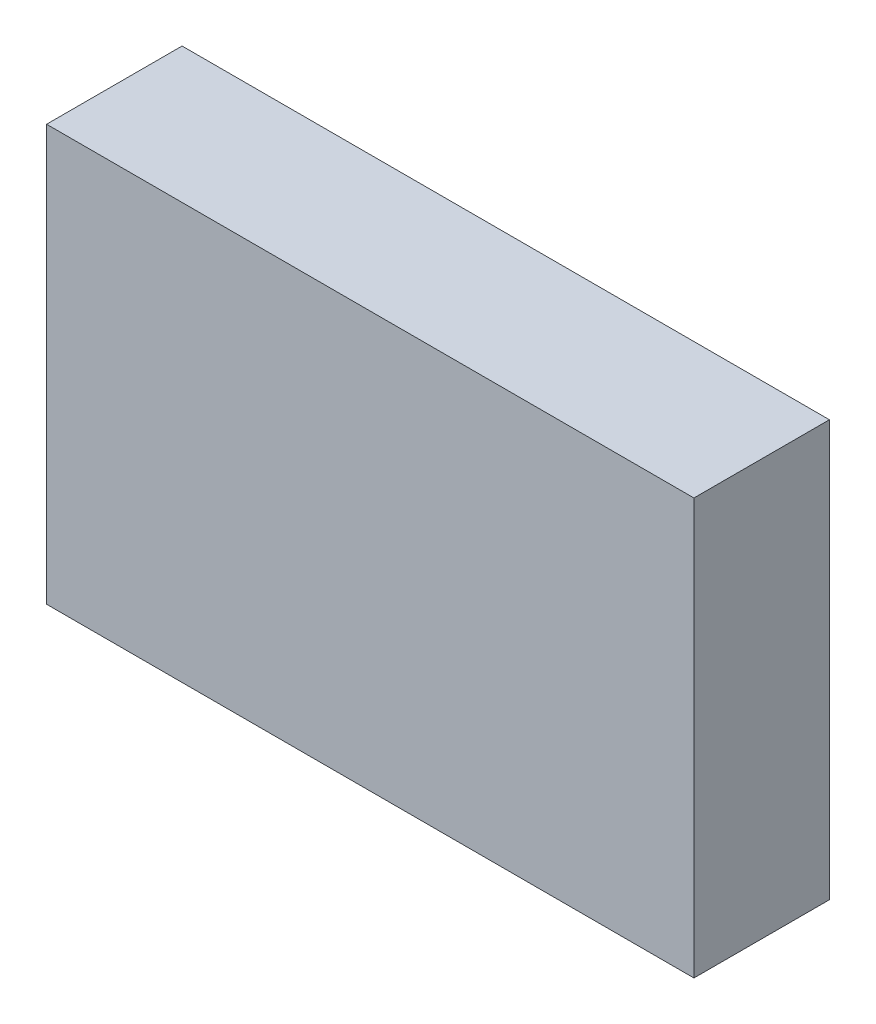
SolidWorks part; units mm, degrees
ref_plane "Front Plane" through (0, 0, 0) normal (0, 0, 1) x (1, 0, 0)
ref_plane "Top Plane" through (0, 0, 0) normal (0, 1, 0) x (1, 0, 0)
ref_plane "Right Plane" through (0, 0, 0) normal (1, 0, 0) x (0, 0, -1)
sketch "Sketch1" plane through (0, 0, 0) normal (0, 0, 1) x (1, 0, 0)
  line L1 (-23.8891, -16.2183) -> (23.8891, -16.2183)
  line L2 (-23.8891, -16.2183) -> (-23.8891, 14.465)
  line L3 (-23.8891, 14.465) -> (23.8891, 14.465)
  line L4 (23.8891, -16.2183) -> (23.8891, 14.465)
  line L5 (-23.8891, -16.2183) -> (23.8891, 14.465) construction
  line L6 (-23.8891, 14.465) -> (23.8891, -16.2183) construction
  point P0 (0, -0.8767)
extrude "Boss-Extrude1" add sketch "Sketch1" along normal blind 10
